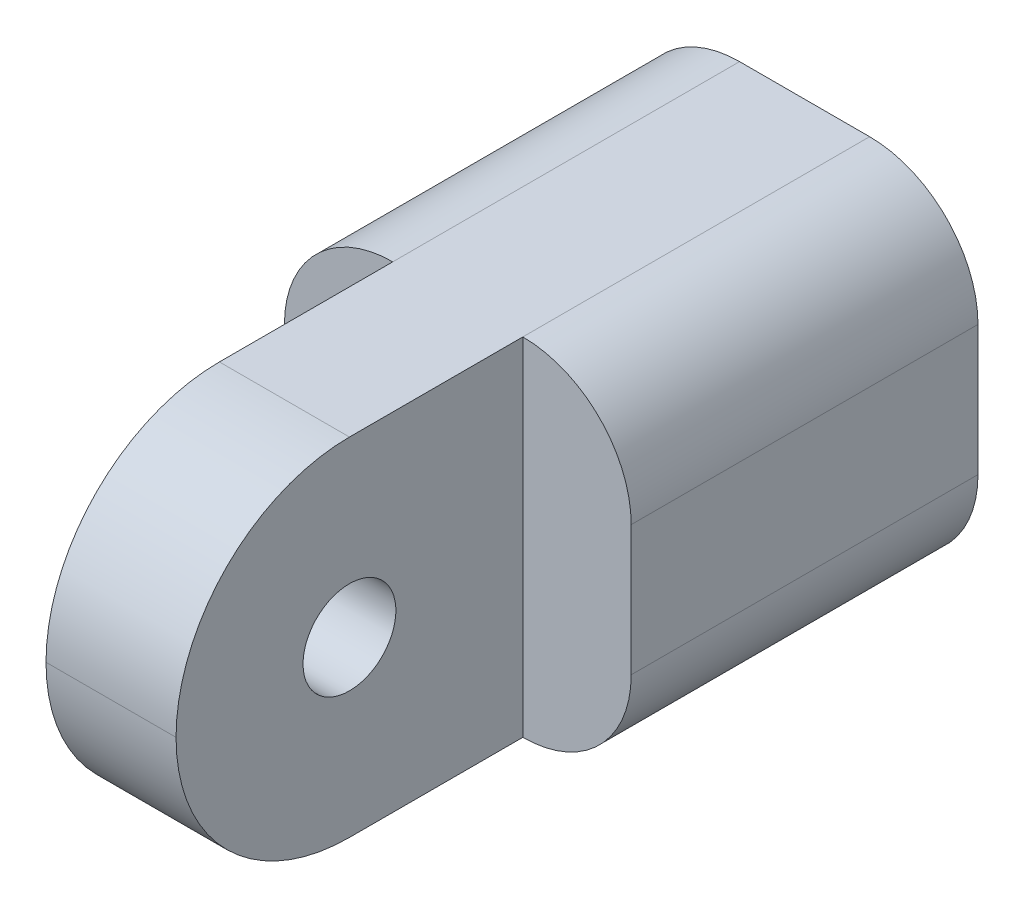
SolidWorks part; units mm, degrees
ref_plane "Front Plane" through (0, 0, 0) normal (0, 0, 1) x (1, 0, 0)
ref_plane "Top Plane" through (0, 0, 0) normal (0, 1, 0) x (1, 0, 0)
ref_plane "Right Plane" through (0, 0, 0) normal (1, 0, 0) x (0, 0, -1)
sketch "Sketch1" plane through (0, 0, 0) normal (0, 0, 1) x (1, 0, 0)
  line L0 (0, -6.35) -> (0, 6.35) construction
  line L5 (-6.35, 6.35) -> (6.35, 6.35)
  line L6 (-6.35, 6.35) -> (-6.35, -6.35)
  line L7 (-6.35, -6.35) -> (6.35, -6.35)
  line L8 (6.35, 6.35) -> (6.35, -6.35)
  point P9 (0, 0)
  dimension "D2" = 12.7
extrude "Boss-Extrude1" add sketch "Sketch1" along normal blind 25.4
fillet "Fillet1" radius 3.9688 4 edges at (6.35, -6.35, 12.7) (-6.35, -6.35, 12.7) (-6.35, 6.35, 12.7) (6.35, 6.35, 12.7)
hole_wizard "Tap Drill for M8x1.25 Tap2" positions "Sketch7" profile "Sketch9" hole size "M8x1.25" standard "ANSI Metric"
sketch "Sketch7" plane through (0, 0, 0) normal (0, 0, -1) x (-1, 0, 0)
  point P0 (0, 0)
sketch "Sketch9" plane through (0, 0, 0) normal (1, 0, 0) x (0, 1, 0)
  line L0 (0, 0) -> (0, 12.0429)
  line L1 (0, 12.0429) -> (3.4, 10)
  line L2 (3.4, 10) -> (3.4, 0)
  line L5 (3.4, 0) -> (0, 0)
  line L10 (0, 12.0429) -> (-3.4, 10) construction
  line L11 (0, -6.35) -> (0, 107.95) construction
  dimension "Hole Dia." = 6.8
  dimension "Hole Depth" = 10
  dimension "Drill Angle" = 118
sketch "Sketch10" plane through (0, 6.35, 0) normal (0, 1, 0) x (1, 0, 0)
  line L0 (-6.35, -25.4) -> (-6.35, 0) construction
  line L1 (-2.3812, -25.4) -> (-6.35, -25.4)
  line L2 (-2.3812, -25.4) -> (-2.3812, -12.7)
  line L3 (-2.3812, -12.7) -> (-6.35, -12.7)
  line L4 (-6.35, -25.4) -> (-6.35, -12.7)
  line L5 (6.35, 0) -> (6.35, -25.4) construction
  line L6 (2.3812, -25.4) -> (6.35, -25.4)
  line L7 (2.3812, -25.4) -> (2.3812, -12.7)
  line L8 (2.3812, -12.7) -> (6.35, -12.7)
  line L9 (6.35, -25.4) -> (6.35, -12.7)
extrude "Cut-Extrude1" cut sketch "Sketch10" against normal through all both and the other way through all
fillet "Fillet2" radius 6.35 2 edges at (0, -6.35, 25.4) (0, 6.35, 25.4)
hole_wizard "M3 Clearance Hole1" positions "Sketch11" profile "Sketch13" hole size "M3" standard "ANSI Metric"
sketch "Sketch11" plane through (-2.3812, 0, 0) normal (-1, 0, 0) x (0, 0, 1)
  point P0 (19.05, 0)
sketch "Sketch13" plane through (-2.3812, 0, 19.05) normal (0, 1, 0) x (0, 0, 1)
  line L0 (0, 0) -> (0, 8.7312)
  line L1 (0, 8.7312) -> (1.7, 8.7312)
  line L2 (1.7, 8.7312) -> (1.7, 0)
  line L5 (1.7, 0) -> (0, 0)
  line L11 (0, -6.35) -> (0, 107.95) construction
  dimension "Thru Hole Dia." = 3.4
  dimension "Thru Hole Depth" = 8.7312
equation "\"D2@Sketch10\"=\"D1@Sketch10\""
